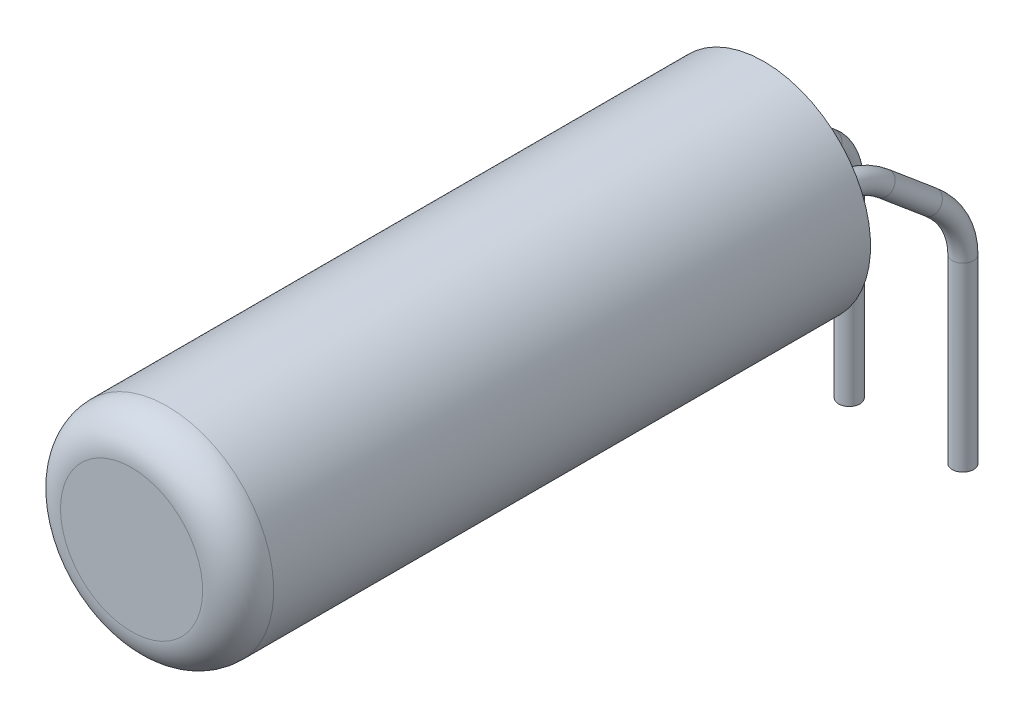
SolidWorks part; units mm, degrees
ref_plane "Front" through (0, 0, 0) normal (0, 0, 1) x (1, 0, 0)
ref_plane "Top" through (0, 0, 0) normal (0, 1, 0) x (1, 0, 0)
ref_plane "Right" through (0, 0, 0) normal (1, 0, 0) x (0, 0, -1)
sketch "Эскиз1" plane through (0, 0, 0) normal (1, 0, 0) x (0, 0, -1)
  line L0 (-10.9, 1.5) -> (-2.2, 1.5)
  line L1 (-2, 0) -> (-10.9, 0)
  line L2 (-2.2, 0.2) -> (-2.2, 1.5)
  line L3 (-2.2, 1.5) -> (-10.9, 1.5) construction
  line L4 (-10.9, 0) -> (-10.9, 1.5)
  line L5 (-2, 0) -> (-2, 0.2)
  line L6 (-2, 0.2) -> (-2.2, 0.2)
  dimension "D1" = 2
  dimension "D2" = 8.9
  dimension "D3" = 3
  dimension "D4" = 0.2
  dimension "D5" = 0.2
revolve "Повернуть1" add sketch "Эскиз1" angle 360 about L3
sketch "Эскиз2" plane through (0, 0, 2.2) normal (0, 0, -1) x (-1, 0, 0)
  line L0 (-1.5, 1.5) -> (1.5, 1.5) construction
  circle A0 centre (-0.55, 1.5) radius 0.15
  circle A1 centre (0, 1.5) radius 1.5 construction
  dimension "D2" = 0.3
  dimension "D1" = 0.55
sketch3d "Трехмерный эскиз1"
  line L0 (0.55, 1.5, 2.2) -> (0.55, 1.5, 1.562)
  line L1 (0.6079, 1.2756, 0.9219) -> (0.7225, 0.832, 0.3722)
  line L2 (0.8, 0.0473, 0) -> (0.8, -2.5, 0)
  line L3 (0, 0, 0) -> (0.8, 0, 0) construction
  arc A0 (0.55, 1.5, 1.562) -> (0.6079, 1.2756, 0.9219) centre (0.8, 0.5318, 1.562) ccw
  arc A1 (0.7225, 0.832, 0.3722) -> (0.8, 0.0473, 0) centre (0.596, 0.0473, 0.979) ccw
  point P10 (0.55, 1.5, 1.2)
  point P11 (-0.1682, 0.2818, 1.562)
  point P14 (0.8, 0.5318, 0)
  point P15 (-0.3829, 0.0473, 0.775)
  dimension "D4" = 1
  dimension "D1" = 0.8
  dimension "D2" = 1
  dimension "D3" = 1
  dimension "D5" = 2.5
sweep "По траектории1" add profiles "Эскиз2" path "Трехмерный эскиз1"
mirror "Зеркальное отражение1" about plane through (0, 0, 0) normal (1, 0, 0) of "По траектории1"
fillet "Скругление1" radius 0.5 1 edges at (0, 3, 10.9)
